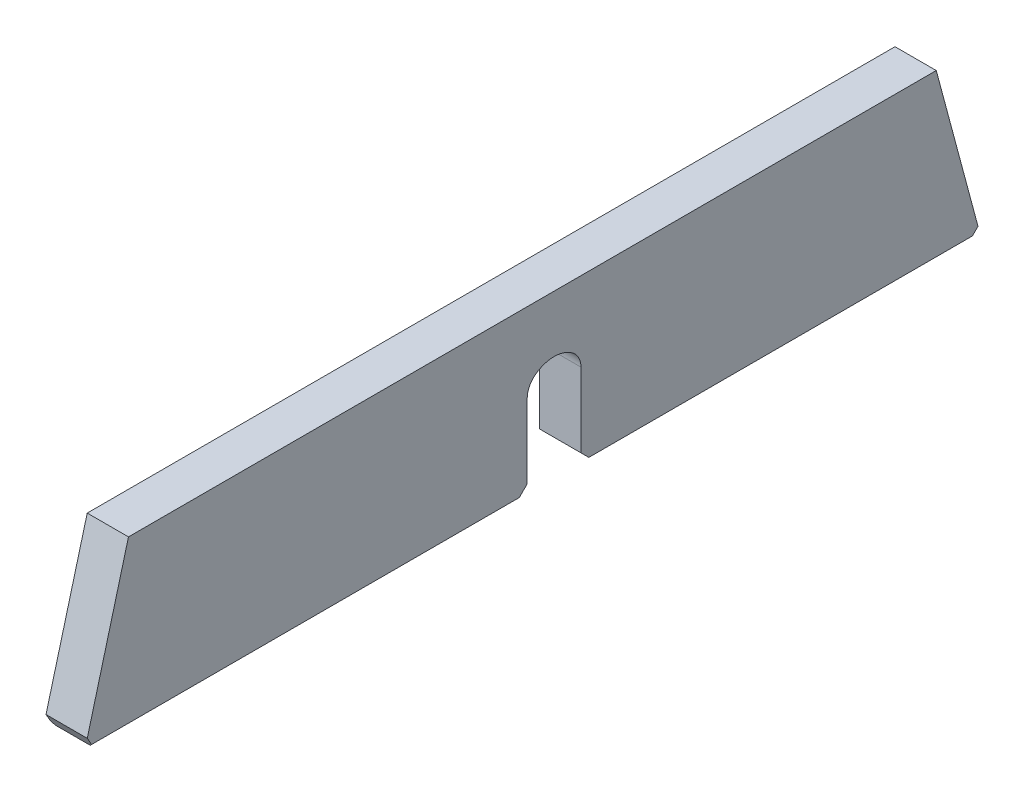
SolidWorks part; units mm, degrees
ref_plane "Front Plane" through (0, 0, 0) normal (1, 0, 0) x (0, 1, 0)
ref_plane "Top Plane" through (0, 0, 0) normal (0, 0, 1) x (0, 1, 0)
ref_plane "Right Plane" through (0, 0, 0) normal (0, 1, 0) x (-1, 0, 0)
sketch "Sketch2" plane through (0, 0, 0) normal (1, 0, 0) x (0, 1, 0)
  line L7 (-405.4975, 1989.725) -> (405.4975, 1989.725)
  line L8 (-405.4975, 1989.725) -> (-405.4975, -1989.725)
  line L9 (-405.4975, -1989.725) -> (405.4975, -1989.725)
  line L10 (405.4975, 1989.725) -> (405.4975, -1989.725)
  line L11 (-405.4975, 1989.725) -> (405.4975, -1989.725) construction
  line L12 (-405.4975, -1989.725) -> (405.4975, 1989.725) construction
  point P0 (0, 0)
  dimension "D1" = 810.995
  dimension "D2" = 3979.45
extrude "Boss-Extrude1" add sketch "Sketch2" along normal mid plane 203.2
sketch "Sketch4" plane through (0, 0, 0) normal (1, 0, 0) x (0, 1, 0)
  line L1 (15.3247, -1491.8985) -> (-689.3864, -1491.8985) construction
  line L3 (-689.3864, -1491.8985) -> (-689.3864, -1756.4625) construction
  line L8 (-689.3864, -1756.4625) -> (15.3247, -1756.4625) construction
  line L9 (-601.143, 860.1015) -> (15.3247, 860.1015) construction
  line L10 (-601.143, 595.5375) -> (15.3247, 595.5375) construction
  line L11 (-601.143, 860.1015) -> (-601.143, 595.5375) construction
  line L12 (-405.4975, -1989.725) -> (405.4975, -1989.725) construction
  line L13 (405.4975, 1989.725) -> (-405.4975, 1989.725) construction
  line L14 (-717.5991, 25.2765) -> (15.3247, 25.2765)
  line L15 (-717.5991, 25.2765) -> (-717.5991, -239.2875)
  line L16 (-717.5991, -239.2875) -> (15.3247, -239.2875)
  line L17 (-405.4975, 1989.725) -> (-405.4975, -1989.725) construction
  arc A4 (93.8403, 822.0313) -> (93.8403, 633.6077) centre (-25.603, 727.8195) cw construction
  arc A5 (93.8403, -1529.9687) -> (93.8403, -1718.3923) centre (-25.603, -1624.1805) cw construction
  arc A6 (93.8403, -12.7937) -> (93.8403, -201.2173) centre (-25.603, -107.0055) cw
  arc A7 (93.8403, -1718.3923) -> (15.3247, -1756.4625) centre (15.3247, -1656.4625) cw construction
  arc A8 (93.8403, -1529.9687) -> (15.3247, -1491.8985) centre (15.3247, -1591.8985) ccw construction
  arc A9 (15.3247, -239.2875) -> (93.8403, -201.2173) centre (15.3247, -139.2875) ccw
  arc A10 (15.3247, 25.2765) -> (93.8403, -12.7937) centre (15.3247, -74.7235) cw
  arc A11 (15.3247, 595.5375) -> (93.8403, 633.6077) centre (15.3247, 695.5375) ccw construction
  arc A12 (15.3247, 860.1015) -> (93.8403, 822.0313) centre (15.3247, 760.1015) cw construction
  point P12 (126.5238, -107.0055)
  point P21 (126.5238, 727.8195)
  point P26 (49.5238, -1756.4625)
  point P29 (49.5238, -1491.8985)
  point P32 (49.5238, -239.2875)
  point P35 (49.5238, 25.2765)
  point P38 (49.5238, 595.5375)
  point P41 (49.5238, 860.1015)
  point P42 (126.5238, -1624.1805)
  dimension "D1" = 233.2625
  dimension "D8" = 100
  dimension "D2" = 497.8265
  dimension "D3" = 1394.1875
  dimension "D4" = 1129.6235
  dimension "D5" = 2015.0015
  dimension "D6" = 1750.4375
  dimension "D7" = 455.0213
  dimension "D9" = 77
extrude "Cut-Extrude2" cut sketch "Sketch4" against normal through all both and the other way through all
sketch "Sketch5" plane through (0, 0, 0) normal (1, 0, 0) x (0, 1, 0)
  line L0 (405.4975, 1989.725) -> (-405.4975, 2207.0305)
  line L1 (-405.4975, 2207.0305) -> (-405.4975, 1989.725)
  line L2 (-405.4975, 1989.725) -> (405.4975, 1989.725)
  line L3 (405.4975, -1989.725) -> (-405.4975, -2207.0305)
  line L4 (-405.4975, -2207.0305) -> (-405.4975, -1989.725)
  line L5 (-405.4975, -1989.725) -> (405.4975, -1989.725)
  dimension "D1" = 15
  dimension "D2" = 15
extrude "Boss-Extrude2" add sketch "Sketch5" along normal mid plane 203.2
chamfer "Chamfer2" distance 16 angle 45 4 edges at (-101.6, -405.4975, -1223.159) (-101.6, -405.4975, 1116.1535) (101.6, -405.4975, -1223.159) (101.6, -405.4975, 1116.1535)
chamfer "Chamfer3" distance 55 angle 45 4 edges at (0, -405.4975, -2207.0305) (0, -405.4975, -239.2875) (0, -405.4975, 25.2765) (0, -405.4975, 2207.0305)
